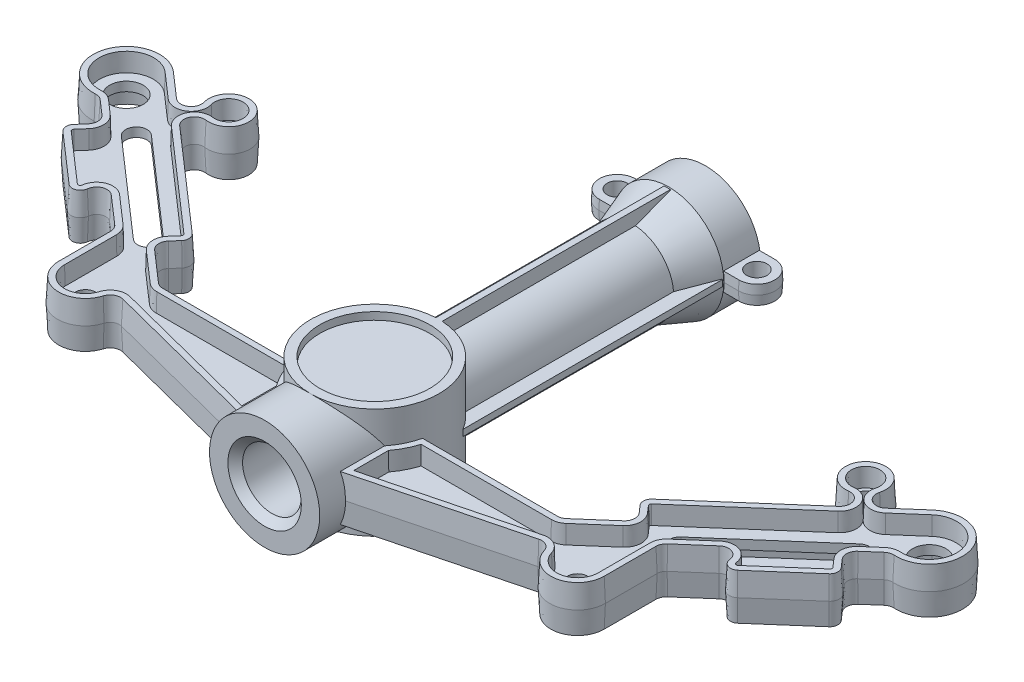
SolidWorks part; units mm, degrees
ref_plane "Front" through (0, 0, 0) normal (0, 0, 1) x (1, 0, 0)
ref_plane "Top" through (0, 0, 0) normal (0, 1, 0) x (1, 0, 0)
ref_plane "Right" through (0, 0, 0) normal (1, 0, 0) x (0, 0, -1)
sketch "Sketch1" plane through (0, 0, 0) normal (0, 1, 0) x (1, 0, 0)
  line L0 (0, 0) -> (0, 142.898) construction
  line L1 (0, 0) -> (19.05, 0)
  line L2 (19.05, 0) -> (19.05, 38.1)
  line L3 (19.05, 38.1) -> (14.4276, 50.8)
  line L4 (14.4276, 50.8) -> (14.4276, 127)
  line L5 (14.4276, 127) -> (19.05, 139.7)
  line L6 (19.05, 139.7) -> (19.05, 152.4)
  line L7 (19.05, 152.4) -> (0, 152.4)
  line L8 (0, 0) -> (0, 152.4)
  dimension "D1" = 152.4
  dimension "D2" = 12.7
  dimension "D3" = 38.1
  dimension "D4" = 160
  dimension "D5" = 160
  dimension "D6" = 38.1
  dimension "D8" = 50.8
revolve "Revolve1" add sketch "Sketch1" angle 360 about L0
sketch "Sketch10" plane through (0, 0, 0) normal (0, 1, 0) x (1, 0, 0)
  line L0 (0, 0) -> (0, 162.8081) construction
  line L2 (-1.5875, 139.7) -> (1.5875, 139.7)
  line L3 (-1.5875, 139.7) -> (-1.5875, 38.1)
  line L4 (-1.5875, 38.1) -> (1.5875, 38.1)
  line L5 (1.5875, 139.7) -> (1.5875, 38.1)
  line L6 (19.05, 139.7) -> (-19.05, 139.7) construction
  line L9 (19.05, 38.1) -> (-19.05, 38.1) construction
  dimension "D1" = 3.175
extrude "Extrude4" add sketch "Sketch10" along normal blind 19.05 draft 1.5
pattern_circular "CirPattern3" count 4 over 360 about axis through (0, 0, 0) along (0, 0, 1) of "Extrude4"
sketch "Sketch3" plane through (0, 0, 0) normal (0, 1, 0) x (1, 0, 0)
  line L0 (0, 0) -> (0, 155.6608) construction
  line L1 (-11.1125, 6.8153) -> (11.1125, 6.8153)
  line L3 (11.1125, 6.8153) -> (71.9997, 22.4857)
  line L4 (-68.2018, 33.3994) -> (68.2018, 33.3994)
  line L5 (70.2912, 34.1838) -> (80.7788, 43.3501)
  line L6 (81.08, 47.8301) -> (78.9152, 50.3069)
  line L7 (79.2164, 54.787) -> (113.6403, 84.874)
  line L8 (94.7002, 41.0055) -> (94.7002, 23.1128)
  line L9 (95.7858, 43.3961) -> (105.3555, 51.7602)
  line L11 (115.8472, 47.6645) -> (132.7202, 62.4117)
  line L12 (133.0213, 66.8917) -> (130.627, 69.6312)
  line L13 (130.9282, 74.1112) -> (135.7735, 78.346)
  line L15 (122.3363, 92.4744) -> (130.9275, 99.9833)
  line L18 (-122.3363, 92.4744) -> (-130.9275, 99.9833)
  line L20 (-130.9282, 74.1112) -> (-135.7735, 78.346)
  line L21 (-133.0213, 66.8917) -> (-130.627, 69.6312)
  line L22 (-115.8472, 47.6645) -> (-132.7202, 62.4117)
  line L23 (-95.7858, 43.3961) -> (-105.3555, 51.7602)
  line L24 (-94.7002, 41.0055) -> (-94.7002, 23.1128)
  line L25 (-79.2164, 54.787) -> (-113.6403, 84.874)
  line L26 (-81.08, 47.8301) -> (-78.9152, 50.3069)
  line L27 (-70.2912, 34.1838) -> (-80.7788, 43.3501)
  line L28 (-11.1125, 6.8153) -> (-71.9997, 22.4857)
  arc A0 (94.7002, 23.1128) -> (75.8307, 20.3281) centre (85.0599, 23.1128) cw
  arc A1 (130.9275, 99.9833) -> (138.053, 79.1247) centre (138.7662, 91.0147) cw
  arc A5 (117.1897, 95.722) -> (111.1108, 90.409) centre (110.0887, 97.7125) ccw
  arc A7 (113.6403, 84.874) -> (111.1108, 90.409) centre (111.5509, 87.2646) ccw
  arc A8 (135.7735, 78.346) -> (138.053, 79.1247) centre (137.8629, 75.9554) cw
  arc A9 (130.627, 69.6312) -> (130.9282, 74.1112) centre (133.0176, 71.7206) cw
  arc A10 (132.7202, 62.4117) -> (133.0213, 66.8917) centre (130.6307, 64.8023) ccw
  arc A11 (78.9152, 50.3069) -> (79.2164, 54.787) centre (81.3058, 52.3964) cw
  arc A12 (80.7788, 43.3501) -> (81.08, 47.8301) centre (78.6894, 45.7407) ccw
  arc A13 (105.3555, 51.7602) -> (110.6013, 49.7124) centre (107.4449, 49.3696) cw
  arc A14 (110.6013, 49.7124) -> (115.8472, 47.6645) centre (113.7578, 50.0551) ccw
  arc A15 (117.1897, 95.722) -> (122.3363, 92.4744) centre (120.2468, 94.865) ccw
  arc A16 (94.7002, 41.0055) -> (95.7858, 43.3961) centre (97.8752, 41.0055) cw
  arc A17 (71.9997, 22.4857) -> (75.8307, 20.3281) centre (72.791, 19.4109) cw
  arc A18 (68.2018, 33.3994) -> (70.2912, 34.1838) centre (68.2018, 36.5744) ccw
  arc A19 (-68.2018, 33.3994) -> (-70.2912, 34.1838) centre (-68.2018, 36.5744) cw
  arc A20 (-71.9997, 22.4857) -> (-75.8307, 20.3281) centre (-72.791, 19.4109) ccw
  arc A21 (-94.7002, 41.0055) -> (-95.7858, 43.3961) centre (-97.8752, 41.0055) ccw
  arc A22 (-117.1897, 95.722) -> (-122.3363, 92.4744) centre (-120.2468, 94.865) cw
  arc A23 (-110.6013, 49.7124) -> (-115.8472, 47.6645) centre (-113.7578, 50.0551) cw
  arc A24 (-105.3555, 51.7602) -> (-110.6013, 49.7124) centre (-107.4449, 49.3696) ccw
  arc A25 (-80.7788, 43.3501) -> (-81.08, 47.8301) centre (-78.6894, 45.7407) cw
  arc A26 (-78.9152, 50.3069) -> (-79.2164, 54.787) centre (-81.3058, 52.3964) ccw
  arc A27 (-132.7202, 62.4117) -> (-133.0213, 66.8917) centre (-130.6307, 64.8023) cw
  arc A28 (-130.627, 69.6312) -> (-130.9282, 74.1112) centre (-133.0176, 71.7206) ccw
  arc A29 (-135.7735, 78.346) -> (-138.053, 79.1247) centre (-137.8629, 75.9554) ccw
  arc A30 (-113.6403, 84.874) -> (-111.1108, 90.409) centre (-111.5509, 87.2646) cw
  arc A32 (-117.1897, 95.722) -> (-111.1108, 90.409) centre (-110.0887, 97.7125) cw
  arc A36 (-130.9275, 99.9833) -> (-138.053, 79.1247) centre (-138.7662, 91.0147) ccw
  arc A37 (-94.7002, 23.1128) -> (-75.8307, 20.3281) centre (-85.0599, 23.1128) ccw
  dimension "D1" = 3.175
  dimension "D2" = 3.175
  dimension "D3" = 3.175
  dimension "D4" = 3.175
  dimension "D13" = 19.2805
  dimension "D21" = 23.8228
  dimension "D22" = 14.7495
  dimension "D5" = 277.5325
  dimension "D6" = 220.1773
  dimension "D7" = 97.7125
  dimension "D8" = 91.0147
  dimension "D9" = 6.8153
  dimension "D10" = 33.3994
  dimension "D11" = 22.225
  dimension "D12" = 14.433
  dimension "D14" = 85.0599
  dimension "D15" = 23.1128
  dimension "D16" = 113.7578
  dimension "D17" = 68.2018
  dimension "D18" = 81.3058
  dimension "D19" = 130.6307
  dimension "D20" = 138.846
  dimension "D23" = 19.4807
  dimension "D24" = 29.469
extrude "Extrude2" add sketch "Sketch3" along normal mid plane 15.875 draft 3
sketch "Sketch2" plane through (0, 0, 0) normal (0, 1, 0) x (1, 0, 0)
  circle A0 centre (0, 38.1) radius 22.225
  dimension "D1" = 44.45
  dimension "D2" = 38.1
extrude "Extrude1" add sketch "Sketch2" along normal mid plane 38.1
sketch "Sketch6" plane through (0, 7.9375, 0) normal (0, 1, 0) x (-1, 0, 0)
  line L26 (19.3496, -11.463) -> (19.3496, -23.4714)
  line L27 (23.1797, -30.9514) -> (68.2018, -30.9514)
  line L28 (71.9022, -32.3406) -> (82.3898, -41.5069)
  line L29 (82.9232, -49.4411) -> (80.7584, -51.9179)
  line L30 (80.8274, -52.9438) -> (115.2513, -83.0308)
  line L31 (123.9472, -90.6312) -> (132.5385, -98.1401)
  line L32 (134.1625, -80.1892) -> (129.3172, -75.9544)
  line L33 (128.7838, -68.0202) -> (131.1781, -65.2808)
  line L34 (131.1092, -64.2549) -> (114.2362, -49.5077)
  line L35 (103.7445, -53.6034) -> (94.1748, -45.2393)
  line L36 (92.2522, -41.0055) -> (92.2522, -23.1128)
  line L37 (71.3895, -24.8564) -> (19.3496, -11.463)
  line L38 (19.3496, -11.463) -> (19.3496, -23.4714)
  line L39 (23.1797, -30.9514) -> (68.2018, -30.9514)
  line L40 (71.9022, -32.3406) -> (82.3898, -41.5069)
  line L41 (82.9232, -49.4411) -> (80.7584, -51.9179)
  line L42 (80.8274, -52.9438) -> (115.2513, -83.0308)
  line L43 (123.9472, -90.6312) -> (132.5385, -98.1401)
  line L44 (134.1625, -80.1892) -> (129.3172, -75.9544)
  line L45 (128.7838, -68.0202) -> (131.1781, -65.2808)
  line L46 (131.1092, -64.2549) -> (114.2362, -49.5077)
  line L47 (103.7445, -53.6034) -> (94.1748, -45.2393)
  line L48 (92.2522, -41.0055) -> (92.2522, -23.1128)
  line L49 (71.3895, -24.8564) -> (19.3496, -11.463)
  line L63 (-68.2018, -30.9514) -> (-23.1797, -30.9514)
  line L64 (-19.3496, -23.4714) -> (-19.3496, -11.463)
  line L65 (-19.3496, -11.463) -> (-71.3895, -24.8564)
  line L66 (-92.2522, -23.1128) -> (-92.2522, -41.0055)
  line L67 (-94.1748, -45.2393) -> (-103.7445, -53.6034)
  line L68 (-114.2362, -49.5077) -> (-131.1092, -64.2549)
  line L69 (-131.1781, -65.2808) -> (-128.7838, -68.0202)
  line L70 (-129.3172, -75.9544) -> (-134.1625, -80.1892)
  line L71 (-132.5385, -98.1401) -> (-123.9472, -90.6312)
  line L72 (-115.2513, -83.0308) -> (-80.8274, -52.9438)
  line L73 (-80.7584, -51.9179) -> (-82.9232, -49.4411)
  line L74 (-82.3898, -41.5069) -> (-71.9022, -32.3406)
  line L75 (-68.2018, -30.9514) -> (-23.1797, -30.9514)
  line L76 (-19.3496, -23.4714) -> (-19.3496, -11.463)
  line L77 (-19.3496, -11.463) -> (-71.3895, -24.8564)
  line L78 (-92.2522, -23.1128) -> (-92.2522, -41.0055)
  line L79 (-94.1748, -45.2393) -> (-103.7445, -53.6034)
  line L80 (-114.2362, -49.5077) -> (-131.1092, -64.2549)
  line L81 (-131.1781, -65.2808) -> (-128.7838, -68.0202)
  line L82 (-129.3172, -75.9544) -> (-134.1625, -80.1892)
  line L83 (-132.5385, -98.1401) -> (-123.9472, -90.6312)
  line L84 (-115.2513, -83.0308) -> (-80.8274, -52.9438)
  line L85 (-80.7584, -51.9179) -> (-82.9232, -49.4411)
  line L86 (-82.3898, -41.5069) -> (-71.9022, -32.3406)
  arc A32 (23.1797, -30.9514) -> (19.3496, -23.4714) centre (0, -38.1) ccw
  arc A33 (71.9022, -32.3406) -> (68.2018, -30.9514) centre (68.2018, -36.5744) ccw
  arc A34 (82.9232, -49.4411) -> (82.3898, -41.5069) centre (78.6894, -45.7407) ccw
  arc A35 (80.7584, -51.9179) -> (80.8274, -52.9438) centre (81.3058, -52.3964) ccw
  arc A36 (110.7715, -92.8333) -> (115.2513, -83.0308) centre (111.5509, -87.2646) ccw
  arc A37 (110.7715, -92.8333) -> (114.8326, -96.3827) centre (110.0887, -97.7125) ccw
  arc A38 (123.9472, -90.6312) -> (114.8326, -96.3827) centre (120.2468, -94.865) ccw
  arc A39 (132.5385, -98.1401) -> (138.1996, -81.5683) centre (138.7662, -91.0147) ccw
  arc A40 (134.1625, -80.1892) -> (138.1996, -81.5683) centre (137.8629, -75.9554) ccw
  arc A41 (128.7838, -68.0202) -> (129.3172, -75.9544) centre (133.0176, -71.7206) ccw
  arc A42 (131.1781, -65.2808) -> (131.1092, -64.2549) centre (130.6307, -64.8023) ccw
  arc A43 (114.2362, -49.5077) -> (113.035, -49.9766) centre (113.7578, -50.0551) ccw
  arc A44 (103.7445, -53.6034) -> (113.035, -49.9766) centre (107.4449, -49.3696) ccw
  arc A45 (92.2522, -41.0055) -> (94.1748, -45.2393) centre (97.8752, -41.0055) ccw
  arc A46 (92.2522, -23.1128) -> (78.1743, -21.0352) centre (85.0599, -23.1128) ccw
  arc A47 (71.3895, -24.8564) -> (78.1743, -21.0352) centre (72.791, -19.4109) ccw
  arc A48 (23.1797, -30.9514) -> (19.3496, -23.4714) centre (0, -38.1) ccw
  arc A49 (71.9022, -32.3406) -> (68.2018, -30.9514) centre (68.2018, -36.5744) ccw
  arc A50 (82.9232, -49.4411) -> (82.3898, -41.5069) centre (78.6894, -45.7407) ccw
  arc A51 (80.7584, -51.9179) -> (80.8274, -52.9438) centre (81.3058, -52.3964) ccw
  arc A52 (110.7715, -92.8333) -> (115.2513, -83.0308) centre (111.5509, -87.2646) ccw
  arc A53 (110.7715, -92.8333) -> (114.8326, -96.3827) centre (110.0887, -97.7125) ccw
  arc A54 (123.9472, -90.6312) -> (114.8326, -96.3827) centre (120.2468, -94.865) ccw
  arc A55 (132.5385, -98.1401) -> (138.1996, -81.5683) centre (138.7662, -91.0147) ccw
  arc A56 (134.1625, -80.1892) -> (138.1996, -81.5683) centre (137.8629, -75.9554) ccw
  arc A57 (128.7838, -68.0202) -> (129.3172, -75.9544) centre (133.0176, -71.7206) ccw
  arc A58 (131.1781, -65.2808) -> (131.1092, -64.2549) centre (130.6307, -64.8023) ccw
  arc A59 (114.2362, -49.5077) -> (113.035, -49.9766) centre (113.7578, -50.0551) ccw
  arc A60 (103.7445, -53.6034) -> (113.035, -49.9766) centre (107.4449, -49.3696) ccw
  arc A61 (92.2522, -41.0055) -> (94.1748, -45.2393) centre (97.8752, -41.0055) ccw
  arc A62 (92.2522, -23.1128) -> (78.1743, -21.0352) centre (85.0599, -23.1128) ccw
  arc A63 (71.3895, -24.8564) -> (78.1743, -21.0352) centre (72.791, -19.4109) ccw
  arc A80 (-19.3496, -23.4714) -> (-23.1797, -30.9514) centre (0, -38.1) ccw
  arc A81 (-78.1743, -21.0352) -> (-71.3895, -24.8564) centre (-72.791, -19.4109) ccw
  arc A82 (-78.1743, -21.0352) -> (-92.2522, -23.1128) centre (-85.0599, -23.1128) ccw
  arc A83 (-94.1748, -45.2393) -> (-92.2522, -41.0055) centre (-97.8752, -41.0055) ccw
  arc A84 (-113.035, -49.9766) -> (-103.7445, -53.6034) centre (-107.4449, -49.3696) ccw
  arc A85 (-113.035, -49.9766) -> (-114.2362, -49.5077) centre (-113.7578, -50.0551) ccw
  arc A86 (-131.1092, -64.2549) -> (-131.1781, -65.2808) centre (-130.6307, -64.8023) ccw
  arc A87 (-129.3172, -75.9544) -> (-128.7838, -68.0202) centre (-133.0176, -71.7206) ccw
  arc A88 (-138.1996, -81.5683) -> (-134.1625, -80.1892) centre (-137.8629, -75.9554) ccw
  arc A89 (-138.1996, -81.5683) -> (-132.5385, -98.1401) centre (-138.7662, -91.0147) ccw
  arc A90 (-114.8326, -96.3827) -> (-123.9472, -90.6312) centre (-120.2468, -94.865) ccw
  arc A91 (-114.8326, -96.3827) -> (-110.7715, -92.8333) centre (-110.0887, -97.7125) ccw
  arc A92 (-115.2513, -83.0308) -> (-110.7715, -92.8333) centre (-111.5509, -87.2646) ccw
  arc A93 (-80.8274, -52.9438) -> (-80.7584, -51.9179) centre (-81.3058, -52.3964) ccw
  arc A94 (-82.3898, -41.5069) -> (-82.9232, -49.4411) centre (-78.6894, -45.7407) ccw
  arc A95 (-68.2018, -30.9514) -> (-71.9022, -32.3406) centre (-68.2018, -36.5744) ccw
  arc A96 (-19.3496, -23.4714) -> (-23.1797, -30.9514) centre (0, -38.1) ccw
  arc A97 (-78.1743, -21.0352) -> (-71.3895, -24.8564) centre (-72.791, -19.4109) ccw
  arc A98 (-78.1743, -21.0352) -> (-92.2522, -23.1128) centre (-85.0599, -23.1128) ccw
  arc A99 (-94.1748, -45.2393) -> (-92.2522, -41.0055) centre (-97.8752, -41.0055) ccw
  arc A100 (-113.035, -49.9766) -> (-103.7445, -53.6034) centre (-107.4449, -49.3696) ccw
  arc A101 (-113.035, -49.9766) -> (-114.2362, -49.5077) centre (-113.7578, -50.0551) ccw
  arc A102 (-131.1092, -64.2549) -> (-131.1781, -65.2808) centre (-130.6307, -64.8023) ccw
  arc A103 (-129.3172, -75.9544) -> (-128.7838, -68.0202) centre (-133.0176, -71.7206) ccw
  arc A104 (-138.1996, -81.5683) -> (-134.1625, -80.1892) centre (-137.8629, -75.9554) ccw
  arc A105 (-138.1996, -81.5683) -> (-132.5385, -98.1401) centre (-138.7662, -91.0147) ccw
  arc A106 (-114.8326, -96.3827) -> (-123.9472, -90.6312) centre (-120.2468, -94.865) ccw
  arc A107 (-114.8326, -96.3827) -> (-110.7715, -92.8333) centre (-110.0887, -97.7125) ccw
  arc A108 (-115.2513, -83.0308) -> (-110.7715, -92.8333) centre (-111.5509, -87.2646) ccw
  arc A109 (-80.8274, -52.9438) -> (-80.7584, -51.9179) centre (-81.3058, -52.3964) ccw
  arc A110 (-82.3898, -41.5069) -> (-82.9232, -49.4411) centre (-78.6894, -45.7407) ccw
  arc A111 (-68.2018, -30.9514) -> (-71.9022, -32.3406) centre (-68.2018, -36.5744) ccw
  dimension "D1" = 2.032
  dimension "D2" = 2.032
extrude "Cut-Extrude3" cut sketch "Sketch6" against normal blind 6.35 draft 1.5
mirror "Mirror2" about plane through (0, 0, 0) normal (0, 1, 0) of "Cut-Extrude3"
sketch "Sketch4" plane through (0, 7.9375, 0) normal (0, 1, 0) x (-1, 0, 0)
  line L0 (79.4901, -54.4737) -> (113.9141, -84.5608) construction
  line L26 (-122.4106, -83.2767) -> (-89.4673, -54.4836)
  line L27 (0, 0) -> (0, -140.9017) construction
  line L28 (127.2518, -77.7377) -> (94.3084, -48.9447)
  line L29 (-127.2518, -77.7377) -> (-94.3084, -48.9447)
  line L30 (-113.9141, -84.5608) -> (-79.4901, -54.4737) construction
  line L31 (122.4106, -83.2767) -> (89.4673, -54.4836)
  circle A32 centre (-110.0887, -97.7125) radius 3.4925
  circle A33 centre (-138.7662, -91.0147) radius 5.7853
  arc A34 (-122.4106, -83.2767) -> (-127.2518, -77.7377) centre (-124.8312, -80.5072) cw
  arc A35 (-89.4673, -54.4836) -> (-94.3084, -48.9447) centre (-91.8878, -51.7141) ccw
  arc A36 (89.4673, -54.4836) -> (94.3084, -48.9447) centre (91.8878, -51.7141) cw
  arc A37 (122.4106, -83.2767) -> (127.2518, -77.7377) centre (124.8312, -80.5072) ccw
  circle A38 centre (138.7662, -91.0147) radius 5.7853
  circle A39 centre (110.0887, -97.7125) radius 3.4925
  circle A41 centre (-85.0599, -23.1128) radius 3.4925
  circle A42 centre (85.0599, -23.1128) radius 3.4925
  dimension "D1" = 6.985
  dimension "D2" = 11.5706
  dimension "D3" = 43.7528
  dimension "D4" = 91.8878
  dimension "D6" = 3.6782
  dimension "D5" = 51.7141
extrude "Cut-Extrude1" cut sketch "Sketch4" against normal through all
sketch "Sketch8" plane through (0, 0, 0) normal (0, 1, 0) x (1, 0, 0)
  line L0 (19.05, 139.7) -> (19.05, 152.4) construction
  line L2 (19.05, 139.2012) -> (19.05, 49.5476) construction
  line L4 (24.13, 152.4) -> (17.526, 152.4)
  line L5 (19.05, 139.7) -> (-19.05, 139.7) construction
  line L7 (17.526, 139.7) -> (24.13, 139.7)
  line L10 (17.526, 152.4) -> (17.526, 139.7)
  line L11 (19.05, 152.4) -> (-19.05, 152.4) construction
  arc A0 (24.13, 139.7) -> (24.13, 152.4) centre (24.13, 146.05) ccw
  dimension "D1" = 1.524
  dimension "D2" = 6.35
  dimension "D3" = 5.08
extrude "Extrude3" add sketch "Sketch8" along normal mid plane 6.35 draft 3
sketch "Sketch9" plane through (0, 3.175, 0) normal (0, 1, 0) x (-1, 0, 0)
  circle A0 centre (-24.13, -146.05) radius 3.4925
  circle A2 centre (-110.0887, -97.7125) radius 3.4925 construction
extrude "Cut-Extrude5" cut sketch "Sketch9" against normal through all
mirror "Mirror3" about plane through (0, 0, 0) normal (1, 0, 0) of "Extrude3", "Cut-Extrude5"
sketch "Sketch7" plane through (0, 0, 0) normal (0, 0, 1) x (1, 0, 0)
  circle A0 centre (0, 0) radius 10.16
  dimension "D1" = 20.32
extrude "Cut-Extrude4" cut sketch "Sketch7" against normal through all
sketch "Sketch5" plane through (0, 19.05, 0) normal (0, 1, 0) x (-1, 0, 0)
  arc A0 (0, -15.875) -> (-1.0887, -60.2983) centre (0, -38.1) ccw construction
  circle A3 centre (0, -38.1) radius 19.05
  dimension "D1" = 38.1
extrude "Cut-Extrude6" cut sketch "Sketch5" against normal blind 2.54 draft 1.5
mirror "Mirror4" about plane through (0, 0, 0) normal (0, 1, 0) of "Cut-Extrude6"
chamfer "Chamfer1" distance 2.54 angle 45 2 edges at (10.16, 0, -152.4) (10.16, 0, 0)
